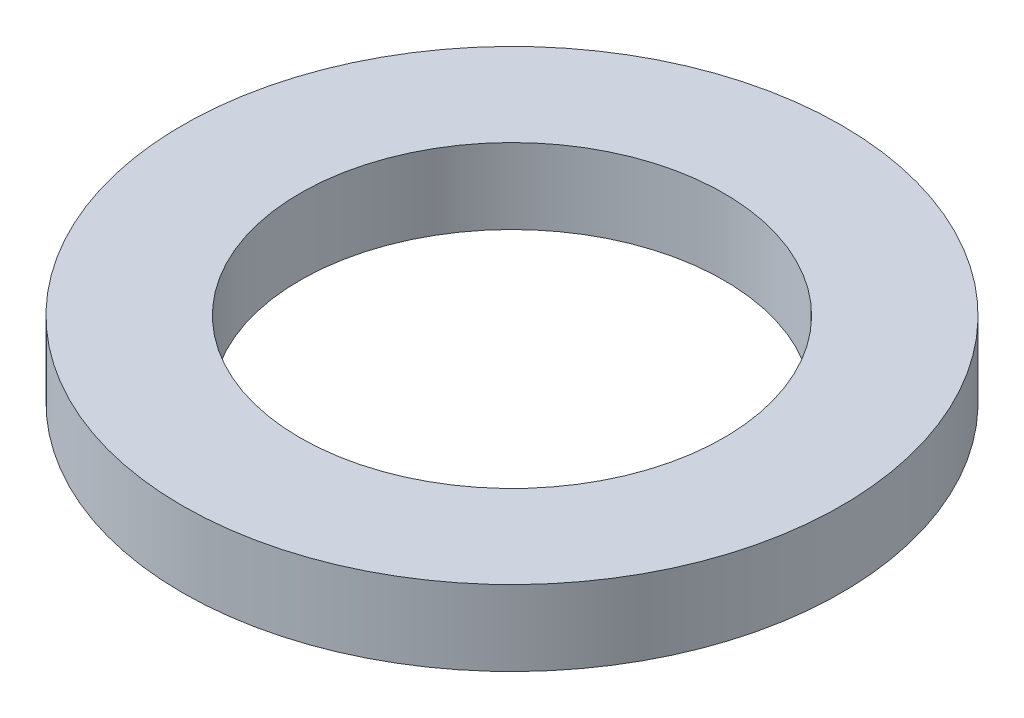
SolidWorks part; units mm, degrees
ref_plane "Front Plane" through (0, 0, 0) normal (0, 0, 1) x (1, 0, 0)
ref_plane "Top Plane" through (0, 0, 0) normal (0, 1, 0) x (1, 0, 0)
ref_plane "Right Plane" through (0, 0, 0) normal (1, 0, 0) x (0, 0, -1)
other "Configuration Table"
sketch "BodySke" plane through (0, 0, 0) normal (0, 0, -1) x (1, 0, 0)
  line L0 (0, 0) -> (0, 7.8986) construction
  line L2 (4.5, 1.6) -> (7, 1.6)
  line L3 (4.5, 1.6) -> (4.5, 0)
  line L4 (4.5, 0) -> (7, 0)
  line L5 (7, 1.6) -> (7, 0)
  dimension "Inner_dia" = 9
  dimension "Outer_dia" = 14
  dimension "Thickness" = 1.6
revolve "BaseBody" add sketch "BodySke" angle 360 about L0
